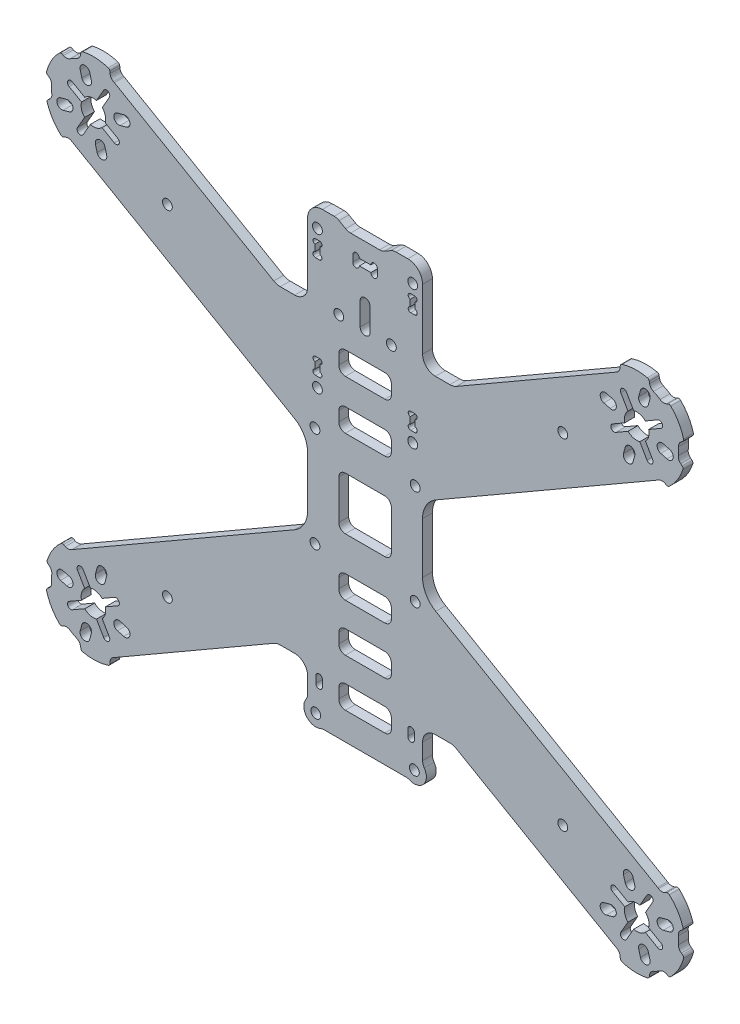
SolidWorks part; units mm, degrees
ref_plane "Plan de face" through (0, 0, 0) normal (0, 0, 1) x (1, 0, 0)
ref_plane "Plan de dessus" through (0, 0, 0) normal (0, 1, 0) x (1, 0, 0)
ref_plane "Plan de droite" through (0, 0, 0) normal (1, 0, 0) x (0, 0, -1)
ref_plane "Plan1" through (0, 0, 0) normal (0, 0, -1) x (-1, 0, 0)
sketch "Esquisse1" plane through (0, 0, 0) normal (0, 0, -1) x (-1, 0, 0)
  line L0 (80.0498, 62.0497) -> (76.2872, 59.8773)
  line L1 (75.2872, 61.6094) -> (79.0498, 63.7818)
  line L2 (80.0067, 67.3528) -> (77.8343, 71.1155)
  line L3 (79.5664, 72.1155) -> (81.7388, 68.3528)
  line L4 (85.3098, 67.396) -> (89.0725, 69.5683)
  line L5 (90.0725, 67.8363) -> (86.3098, 65.6639)
  line L6 (85.353, 62.0928) -> (87.5253, 58.3302)
  line L7 (85.7933, 57.3302) -> (83.6209, 61.0928)
  line L8 (83.2974, 72.8231) -> (83.8094, 74.7339)
  line L9 (86.7072, 73.9575) -> (86.1952, 72.0467)
  line L10 (90.7801, 64.1053) -> (92.6909, 63.5933)
  line L11 (91.9145, 60.6955) -> (90.0037, 61.2075)
  line L12 (74.5795, 65.3404) -> (72.6688, 65.8524)
  line L13 (73.4452, 68.7502) -> (75.356, 68.2382)
  line L14 (82.0623, 56.6225) -> (81.5503, 54.7117)
  line L15 (78.6525, 55.4882) -> (79.1645, 57.399)
  line L16 (-77.8343, 71.1155) -> (-80.0067, 67.3528)
  line L17 (-79.0498, 63.7818) -> (-75.2872, 61.6094)
  line L18 (-76.2872, 59.8773) -> (-80.0498, 62.0497)
  line L19 (-83.6209, 61.0928) -> (-85.7933, 57.3302)
  line L20 (-87.5253, 58.3302) -> (-85.353, 62.0928)
  line L21 (-86.3098, 65.6639) -> (-90.0725, 67.8363)
  line L22 (-89.0725, 69.5683) -> (-85.3098, 67.396)
  line L23 (-81.7388, 68.3528) -> (-79.5664, 72.1155)
  line L24 (-83.8094, 74.7339) -> (-83.2974, 72.8231)
  line L25 (-86.1952, 72.0467) -> (-86.7072, 73.9575)
  line L26 (-92.6909, 63.5933) -> (-90.7801, 64.1053)
  line L27 (-90.0037, 61.2075) -> (-91.9145, 60.6955)
  line L28 (-72.6688, 65.8524) -> (-74.5795, 65.3404)
  line L29 (-75.356, 68.2382) -> (-73.4452, 68.7502)
  line L30 (-81.5503, 54.7117) -> (-82.0623, 56.6225)
  line L31 (-79.1645, 57.399) -> (-78.6525, 55.4882)
  line L32 (77.8343, -71.1155) -> (80.0067, -67.3528)
  line L33 (79.0498, -63.7818) -> (75.2872, -61.6094)
  line L34 (76.2872, -59.8773) -> (80.0498, -62.0497)
  line L35 (83.6209, -61.0928) -> (85.7933, -57.3302)
  line L36 (87.5253, -58.3302) -> (85.353, -62.0928)
  line L37 (86.3098, -65.6639) -> (90.0725, -67.8363)
  line L38 (89.0725, -69.5683) -> (85.3098, -67.396)
  line L39 (81.7388, -68.3528) -> (79.5664, -72.1155)
  line L40 (83.8094, -74.7339) -> (83.2974, -72.8231)
  line L41 (86.1952, -72.0467) -> (86.7072, -73.9575)
  line L42 (92.6909, -63.5933) -> (90.7801, -64.1053)
  line L43 (90.0037, -61.2075) -> (91.9145, -60.6955)
  line L44 (72.6688, -65.8524) -> (74.5795, -65.3404)
  line L45 (75.356, -68.2382) -> (73.4452, -68.7502)
  line L46 (81.5503, -54.7117) -> (82.0623, -56.6225)
  line L47 (79.1645, -57.399) -> (78.6525, -55.4882)
  line L48 (-80.0498, -62.0497) -> (-76.2872, -59.8773)
  line L49 (-75.2872, -61.6094) -> (-79.0498, -63.7818)
  line L50 (-80.0067, -67.3528) -> (-77.8343, -71.1155)
  line L51 (-79.5664, -72.1155) -> (-81.7388, -68.3528)
  line L52 (-85.3098, -67.396) -> (-89.0725, -69.5683)
  line L53 (-90.0725, -67.8363) -> (-86.3098, -65.6639)
  line L54 (-85.353, -62.0928) -> (-87.5253, -58.3302)
  line L55 (-85.7933, -57.3302) -> (-83.6209, -61.0928)
  line L56 (-83.2974, -72.8231) -> (-83.8094, -74.7339)
  line L57 (-86.7072, -73.9575) -> (-86.1952, -72.0467)
  line L58 (-90.7801, -64.1053) -> (-92.6909, -63.5933)
  line L59 (-91.9145, -60.6955) -> (-90.0037, -61.2075)
  line L60 (-74.5795, -65.3404) -> (-72.6688, -65.8524)
  line L61 (-73.4452, -68.7502) -> (-75.356, -68.2382)
  line L62 (-82.0623, -56.6225) -> (-81.5503, -54.7117)
  line L63 (-78.6525, -55.4882) -> (-79.1645, -57.399)
  line L64 (6, 18.5) -> (-6, 18.5)
  line L65 (-8, 20.5) -> (-8, 23.5)
  line L66 (-6, 25.5) -> (6, 25.5)
  line L67 (8, 23.5) -> (8, 20.5)
  line L68 (-8, -23.5) -> (-8, -20.5)
  line L69 (-6, -18.5) -> (6, -18.5)
  line L70 (8, -20.5) -> (8, -23.5)
  line L71 (6, -25.5) -> (-6, -25.5)
  line L72 (8, -35) -> (8, -38)
  line L73 (6, -40) -> (-6, -40)
  line L74 (-8, -38) -> (-8, -35)
  line L75 (-6, -33) -> (6, -33)
  line L76 (6, -8) -> (-6, -8)
  line L77 (-8, -6) -> (-8, 6)
  line L78 (-6, 8) -> (6, 8)
  line L79 (8, 6) -> (8, -6)
  line L80 (-6, 40.5) -> (6, 40.5)
  line L81 (8, 38.5) -> (8, 35.5)
  line L82 (6, 33.5) -> (-6, 33.5)
  line L83 (-8, 35.5) -> (-8, 38.5)
  line L84 (8, -49.5) -> (8, -52.5)
  line L85 (6, -54.5) -> (-6, -54.5)
  line L86 (-8, -52.5) -> (-8, -49.5)
  line L87 (-6, -47.5) -> (6, -47.5)
  line L88 (1.75, 64.75) -> (-1.7553, 64.75)
  line L89 (-3.7447, 64.7474) -> (-3.75, 66.7473)
  line L90 (-1.75, 66.75) -> (1.75, 66.75)
  line L91 (3.75, 66.75) -> (3.75, 64.75)
  line L92 (-13.75, 63.7467) -> (-13.75, 61.7326)
  line L93 (-13.875, 60.2431) -> (-15.125, 60.2431)
  line L94 (-15.25, 61.7326) -> (-15.25, 63.7467)
  line L95 (-15.125, 65.25) -> (-13.875, 65.25)
  line L96 (13, -51.8906) -> (13, -49.8906)
  line L97 (15, -49.8906) -> (15, -51.8906)
  line L98 (-13.875, 29.25) -> (-15.125, 29.25)
  line L99 (-15.25, 30.7533) -> (-15.25, 32.7674)
  line L100 (-15.125, 34.2569) -> (-13.875, 34.2569)
  line L101 (-13.75, 32.7674) -> (-13.75, 30.7533)
  line L102 (13.875, 34.2569) -> (15.125, 34.2569)
  line L103 (15.25, 32.7674) -> (15.25, 30.7533)
  line L104 (15.125, 29.25) -> (13.875, 29.25)
  line L105 (13.75, 30.7533) -> (13.75, 32.7674)
  line L106 (-1.5, 48.75) -> (-1.5, 55.75)
  line L107 (1.5, 55.75) -> (1.5, 48.75)
  line L108 (-13, -49.8906) -> (-13, -51.8906)
  line L109 (-15, -51.8906) -> (-15, -49.8906)
  line L110 (15.25, 63.7467) -> (15.25, 61.7326)
  line L111 (15.125, 60.2431) -> (13.875, 60.2431)
  line L112 (13.75, 61.7326) -> (13.75, 63.7467)
  line L113 (13.875, 65.25) -> (15.125, 65.25)
  line L114 (13, 74) -> (9.4042, 74)
  line L115 (7.9164, 73.6051) -> (5.9144, 72.4617)
  line L116 (4.4266, 72.0668) -> (-4.4266, 72.0668)
  line L117 (-5.9144, 72.4617) -> (-7.9164, 73.6051)
  line L118 (-9.4042, 74) -> (-13, 74)
  line L119 (-17.5, 69.5) -> (-17.5, 51.1368)
  line L120 (-21.4101, 47.2267) -> (-25.8039, 47.2267)
  line L121 (-27.8039, 47.7626) -> (-76.3048, 75.7647)
  line L122 (-77.6193, 77.4979) -> (-77.6741, 78.1059)
  line L123 (-86.5001, 78.4912) -> (-86.6077, 77.8903)
  line L124 (-91.7746, 75.1592) -> (-92.1745, 75.3509)
  line L125 (-96.6313, 67.6315) -> (-96.2654, 67.3809)
  line L126 (-96.0472, 61.5408) -> (-96.5137, 61.1471)
  line L127 (-91.767, 53.6962) -> (-91.213, 53.9527)
  line L128 (-89.0548, 53.681) -> (-21.5, 14.6782)
  line L129 (-17.5, 7.75) -> (-17.5, -7.75)
  line L130 (-21.5, -14.6782) -> (-89.0548, -53.681)
  line L131 (-91.213, -53.9527) -> (-91.767, -53.6962)
  line L132 (-96.5137, -61.1471) -> (-96.0472, -61.5408)
  line L133 (-96.2654, -67.3809) -> (-96.6313, -67.6315)
  line L134 (-92.1745, -75.3509) -> (-91.7746, -75.1592)
  line L135 (-86.6077, -77.8903) -> (-86.5001, -78.4912)
  line L136 (-77.6741, -78.1059) -> (-77.6193, -77.4979)
  line L137 (-76.3048, -75.7647) -> (-27.8039, -47.7626)
  line L138 (-25.8039, -47.2267) -> (-21.4101, -47.2267)
  line L139 (-17.5, -51.1368) -> (-17.5, -56.0075)
  line L140 (-12.4408, -62.8906) -> (12.4408, -62.8906)
  line L141 (17.5, -56.0075) -> (17.5, -51.1368)
  line L142 (21.4101, -47.2267) -> (25.8039, -47.2267)
  line L143 (27.8039, -47.7626) -> (76.3048, -75.7647)
  line L144 (77.6193, -77.4979) -> (77.6741, -78.1059)
  line L145 (86.5001, -78.4912) -> (86.6077, -77.8903)
  line L146 (91.7746, -75.1592) -> (92.1745, -75.3509)
  line L147 (96.6313, -67.6315) -> (96.2654, -67.3809)
  line L148 (96.0472, -61.5408) -> (96.5137, -61.1471)
  line L149 (91.767, -53.6962) -> (91.213, -53.9527)
  line L150 (89.0548, -53.681) -> (21.5, -14.6782)
  line L151 (17.5, -7.75) -> (17.5, 7.75)
  line L152 (21.5, 14.6782) -> (89.0548, 53.681)
  line L153 (91.213, 53.9527) -> (91.767, 53.6962)
  line L154 (96.5137, 61.1471) -> (96.0472, 61.5408)
  line L155 (96.2654, 67.3809) -> (96.6313, 67.6315)
  line L156 (92.1745, 75.3509) -> (91.7746, 75.1592)
  line L157 (86.6077, 77.8903) -> (86.5001, 78.4912)
  line L158 (77.6741, 78.1059) -> (77.6193, 77.4979)
  line L159 (76.3048, 75.7647) -> (27.8039, 47.7626)
  line L160 (25.8039, 47.2267) -> (21.4101, 47.2267)
  line L161 (17.5, 51.1368) -> (17.5, 69.5)
  arc A0 (76.2872, 59.8773) -> (75.2872, 61.6094) centre (75.7872, 60.7433) cw
  arc A1 (79.0498, 63.7818) -> (80.0067, 67.3528) centre (82.6798, 64.7228) cw
  arc A2 (77.8343, 71.1155) -> (79.5664, 72.1155) centre (78.7004, 71.6155) cw
  arc A3 (81.7388, 68.3528) -> (85.3098, 67.396) centre (82.6798, 64.7228) cw
  arc A4 (89.0725, 69.5683) -> (90.0725, 67.8363) centre (89.5725, 68.7023) cw
  arc A5 (86.3098, 65.6639) -> (85.353, 62.0928) centre (82.6798, 64.7228) cw
  arc A6 (87.5253, 58.3302) -> (85.7933, 57.3302) centre (86.6593, 57.8302) cw
  arc A7 (83.6209, 61.0928) -> (80.0498, 62.0497) centre (82.6798, 64.7228) cw
  arc A8 (83.8094, 74.7339) -> (86.7072, 73.9575) centre (85.2583, 74.3457) cw
  arc A9 (86.1952, 72.0467) -> (83.2974, 72.8231) centre (84.7463, 72.4349) cw
  arc A10 (92.6909, 63.5933) -> (91.9145, 60.6955) centre (92.3027, 62.1444) cw
  arc A11 (90.0037, 61.2075) -> (90.7801, 64.1053) centre (90.3919, 62.6564) cw
  arc A12 (72.6688, 65.8524) -> (73.4452, 68.7502) centre (73.057, 67.3013) cw
  arc A13 (75.356, 68.2382) -> (74.5795, 65.3404) centre (74.9678, 66.7893) cw
  arc A14 (81.5503, 54.7117) -> (78.6525, 55.4882) centre (80.1014, 55.1) cw
  arc A15 (79.1645, 57.399) -> (82.0623, 56.6225) centre (80.6134, 57.0108) cw
  arc A16 (-80.0067, 67.3528) -> (-79.0498, 63.7818) centre (-82.6798, 64.7228) cw
  arc A17 (-75.2872, 61.6094) -> (-76.2872, 59.8773) centre (-75.7872, 60.7433) cw
  arc A18 (-80.0498, 62.0497) -> (-83.6209, 61.0928) centre (-82.6798, 64.7228) cw
  arc A19 (-85.7933, 57.3302) -> (-87.5253, 58.3302) centre (-86.6593, 57.8302) cw
  arc A20 (-85.353, 62.0928) -> (-86.3098, 65.6639) centre (-82.6798, 64.7228) cw
  arc A21 (-90.0725, 67.8363) -> (-89.0725, 69.5683) centre (-89.5725, 68.7023) cw
  arc A22 (-85.3098, 67.396) -> (-81.7388, 68.3528) centre (-82.6798, 64.7228) cw
  arc A23 (-79.5664, 72.1155) -> (-77.8343, 71.1155) centre (-78.7004, 71.6155) cw
  arc A24 (-83.2974, 72.8231) -> (-86.1952, 72.0467) centre (-84.7463, 72.4349) cw
  arc A25 (-86.7072, 73.9575) -> (-83.8094, 74.7339) centre (-85.2583, 74.3457) cw
  arc A26 (-90.7801, 64.1053) -> (-90.0037, 61.2075) centre (-90.3919, 62.6564) cw
  arc A27 (-91.9145, 60.6955) -> (-92.6909, 63.5933) centre (-92.3027, 62.1444) cw
  arc A28 (-74.5795, 65.3404) -> (-75.356, 68.2382) centre (-74.9678, 66.7893) cw
  arc A29 (-73.4452, 68.7502) -> (-72.6688, 65.8524) centre (-73.057, 67.3013) cw
  arc A30 (-82.0623, 56.6225) -> (-79.1645, 57.399) centre (-80.6134, 57.0108) cw
  arc A31 (-78.6525, 55.4882) -> (-81.5503, 54.7117) centre (-80.1014, 55.1) cw
  arc A32 (80.0067, -67.3528) -> (79.0498, -63.7818) centre (82.6798, -64.7228) cw
  arc A33 (75.2872, -61.6094) -> (76.2872, -59.8773) centre (75.7872, -60.7433) cw
  arc A34 (80.0498, -62.0497) -> (83.6209, -61.0928) centre (82.6798, -64.7228) cw
  arc A35 (85.7933, -57.3302) -> (87.5253, -58.3302) centre (86.6593, -57.8302) cw
  arc A36 (85.353, -62.0928) -> (86.3098, -65.6639) centre (82.6798, -64.7228) cw
  arc A37 (90.0725, -67.8363) -> (89.0725, -69.5683) centre (89.5725, -68.7023) cw
  arc A38 (85.3098, -67.396) -> (81.7388, -68.3528) centre (82.6798, -64.7228) cw
  arc A39 (79.5664, -72.1155) -> (77.8343, -71.1155) centre (78.7004, -71.6155) cw
  arc A40 (83.2974, -72.8231) -> (86.1952, -72.0467) centre (84.7463, -72.4349) cw
  arc A41 (86.7072, -73.9575) -> (83.8094, -74.7339) centre (85.2583, -74.3457) cw
  arc A42 (90.7801, -64.1053) -> (90.0037, -61.2075) centre (90.3919, -62.6564) cw
  arc A43 (91.9145, -60.6955) -> (92.6909, -63.5933) centre (92.3027, -62.1444) cw
  arc A44 (74.5795, -65.3404) -> (75.356, -68.2382) centre (74.9678, -66.7893) cw
  arc A45 (73.4452, -68.7502) -> (72.6688, -65.8524) centre (73.057, -67.3013) cw
  arc A46 (82.0623, -56.6225) -> (79.1645, -57.399) centre (80.6134, -57.0108) cw
  arc A47 (78.6525, -55.4882) -> (81.5503, -54.7117) centre (80.1014, -55.1) cw
  arc A48 (-76.2872, -59.8773) -> (-75.2872, -61.6094) centre (-75.7872, -60.7433) cw
  arc A49 (-79.0498, -63.7818) -> (-80.0067, -67.3528) centre (-82.6798, -64.7228) cw
  arc A50 (-77.8343, -71.1155) -> (-79.5664, -72.1155) centre (-78.7004, -71.6155) cw
  arc A51 (-81.7388, -68.3528) -> (-85.3098, -67.396) centre (-82.6798, -64.7228) cw
  arc A52 (-89.0725, -69.5683) -> (-90.0725, -67.8363) centre (-89.5725, -68.7023) cw
  arc A53 (-86.3098, -65.6639) -> (-85.353, -62.0928) centre (-82.6798, -64.7228) cw
  arc A54 (-87.5253, -58.3302) -> (-85.7933, -57.3302) centre (-86.6593, -57.8302) cw
  arc A55 (-83.6209, -61.0928) -> (-80.0498, -62.0497) centre (-82.6798, -64.7228) cw
  arc A56 (-83.8094, -74.7339) -> (-86.7072, -73.9575) centre (-85.2583, -74.3457) cw
  arc A57 (-86.1952, -72.0467) -> (-83.2974, -72.8231) centre (-84.7463, -72.4349) cw
  arc A58 (-92.6909, -63.5933) -> (-91.9145, -60.6955) centre (-92.3027, -62.1444) cw
  arc A59 (-90.0037, -61.2075) -> (-90.7801, -64.1053) centre (-90.3919, -62.6564) cw
  arc A60 (-72.6688, -65.8524) -> (-73.4452, -68.7502) centre (-73.057, -67.3013) cw
  arc A61 (-75.356, -68.2382) -> (-74.5795, -65.3404) centre (-74.9678, -66.7893) cw
  arc A62 (-81.5503, -54.7117) -> (-78.6525, -55.4882) centre (-80.1014, -55.1) cw
  arc A63 (-79.1645, -57.399) -> (-82.0623, -56.6225) centre (-80.6134, -57.0108) cw
  circle A64 centre (15, -59.75) radius 1.5
  circle A65 centre (-14.5, 68.25) radius 1.5
  circle A66 centre (14.5, 26.25) radius 1.5
  circle A67 centre (-15.25, 15.25) radius 1.5
  circle A68 centre (15.25, -15.25) radius 1.5
  circle A69 centre (15.25, 15.25) radius 1.5
  circle A70 centre (-15.25, -15.25) radius 1.5
  circle A71 centre (-14.5, 26.25) radius 1.5
  circle A72 centre (14.5, 68.25) radius 1.5
  circle A73 centre (-15, -59.75) radius 1.5
  arc A74 (-6, 18.5) -> (-8, 20.5) centre (-6, 20.5) cw
  arc A75 (-8, 23.5) -> (-6, 25.5) centre (-6, 23.5) cw
  arc A76 (6, 25.5) -> (8, 23.5) centre (6, 23.5) cw
  arc A77 (8, 20.5) -> (6, 18.5) centre (6, 20.5) cw
  arc A78 (-8, -20.5) -> (-6, -18.5) centre (-6, -20.5) cw
  arc A79 (6, -18.5) -> (8, -20.5) centre (6, -20.5) cw
  arc A80 (8, -23.5) -> (6, -25.5) centre (6, -23.5) cw
  arc A81 (-6, -25.5) -> (-8, -23.5) centre (-6, -23.5) cw
  arc A82 (8, -38) -> (6, -40) centre (6, -38) cw
  arc A83 (-6, -40) -> (-8, -38) centre (-6, -38) cw
  arc A84 (-8, -35) -> (-6, -33) centre (-6, -35) cw
  arc A85 (6, -33) -> (8, -35) centre (6, -35) cw
  arc A86 (-6, -8) -> (-8, -6) centre (-6, -6) cw
  arc A87 (-8, 6) -> (-6, 8) centre (-6, 6) cw
  arc A88 (6, 8) -> (8, 6) centre (6, 6) cw
  arc A89 (8, -6) -> (6, -8) centre (6, -6) cw
  arc A90 (6, 40.5) -> (8, 38.5) centre (6, 38.5) cw
  arc A91 (8, 35.5) -> (6, 33.5) centre (6, 35.5) cw
  arc A92 (-6, 33.5) -> (-8, 35.5) centre (-6, 35.5) cw
  arc A93 (-8, 38.5) -> (-6, 40.5) centre (-6, 38.5) cw
  arc A94 (8, -52.5) -> (6, -54.5) centre (6, -52.5) cw
  arc A95 (-6, -54.5) -> (-8, -52.5) centre (-6, -52.5) cw
  arc A96 (-8, -49.5) -> (-6, -47.5) centre (-6, -49.5) cw
  arc A97 (6, -47.5) -> (8, -49.5) centre (6, -49.5) cw
  arc A98 (-1.7553, 64.75) -> (-3.7447, 64.7474) centre (-2.75, 64.75) cw
  arc A99 (-3.75, 66.7473) -> (-1.75, 66.75) centre (-2.75, 66.75) cw
  arc A100 (1.75, 66.75) -> (3.75, 66.75) centre (2.75, 66.75) cw
  arc A101 (3.75, 64.75) -> (1.75, 64.75) centre (2.75, 64.75) cw
  arc A102 (-13.875, 65.25) -> (-13.75, 63.7467) centre (-13.875, 64.4931) cw
  arc A103 (-13.75, 61.7326) -> (-13.875, 60.2431) centre (-13.875, 60.9931) cw
  arc A104 (-15.125, 60.2431) -> (-15.25, 61.7326) centre (-15.125, 60.9931) cw
  arc A105 (-15.25, 63.7467) -> (-15.125, 65.25) centre (-15.125, 64.4931) cw
  arc A106 (13, -49.8906) -> (15, -49.8906) centre (14, -49.8906) cw
  arc A107 (15, -51.8906) -> (13, -51.8906) centre (14, -51.8906) cw
  arc A108 (-15.125, 29.25) -> (-15.25, 30.7533) centre (-15.125, 30.0069) cw
  arc A109 (-15.25, 32.7674) -> (-15.125, 34.2569) centre (-15.125, 33.5069) cw
  arc A110 (-13.875, 34.2569) -> (-13.75, 32.7674) centre (-13.875, 33.5069) cw
  arc A111 (-13.75, 30.7533) -> (-13.875, 29.25) centre (-13.875, 30.0069) cw
  arc A112 (15.125, 34.2569) -> (15.25, 32.7674) centre (15.125, 33.5069) cw
  arc A113 (15.25, 30.7533) -> (15.125, 29.25) centre (15.125, 30.0069) cw
  arc A114 (13.875, 29.25) -> (13.75, 30.7533) centre (13.875, 30.0069) cw
  arc A115 (13.75, 32.7674) -> (13.875, 34.2569) centre (13.875, 33.5069) cw
  arc A116 (-1.5, 55.75) -> (1.5, 55.75) centre (0, 55.75) cw
  arc A117 (1.5, 48.75) -> (-1.5, 48.75) centre (0, 48.75) cw
  arc A118 (-13, -51.8906) -> (-15, -51.8906) centre (-14, -51.8906) cw
  arc A119 (-15, -49.8906) -> (-13, -49.8906) centre (-14, -49.8906) cw
  arc A120 (15.25, 61.7326) -> (15.125, 60.2431) centre (15.125, 60.9931) cw
  arc A121 (13.875, 60.2431) -> (13.75, 61.7326) centre (13.875, 60.9931) cw
  arc A122 (13.75, 63.7467) -> (13.875, 65.25) centre (13.875, 64.4931) cw
  arc A123 (15.125, 65.25) -> (15.25, 63.7467) centre (15.125, 64.4931) cw
  circle A124 centre (8, 48.75) radius 1.5
  circle A125 centre (-8, 48.75) radius 1.5
  circle A126 centre (-60.1632, 51.7228) radius 1.5
  circle A127 centre (60.1632, -51.7228) radius 1.5
  circle A128 centre (-60.1632, -51.7228) radius 1.5
  circle A129 centre (60.1632, 51.7228) radius 1.5
  arc A130 (17.5, 69.5) -> (13, 74) centre (13, 69.5) ccw
  arc A131 (9.4042, 74) -> (7.9164, 73.6051) centre (9.4042, 71) ccw
  arc A132 (5.9144, 72.4617) -> (4.4266, 72.0668) centre (4.4266, 75.0668) cw
  arc A133 (-4.4266, 72.0668) -> (-5.9144, 72.4617) centre (-4.4266, 75.0668) cw
  arc A134 (-7.9164, 73.6051) -> (-9.4042, 74) centre (-9.4042, 71) ccw
  arc A135 (-13, 74) -> (-17.5, 69.5) centre (-13, 69.5) ccw
  arc A136 (-17.5, 51.1368) -> (-21.4101, 47.2267) centre (-21.4101, 51.1368) cw
  arc A137 (-25.8039, 47.2267) -> (-27.8039, 47.7626) centre (-25.8039, 51.2267) cw
  arc A138 (-76.3048, 75.7647) -> (-76.5836, 75.921) centre (-82.6798, 64.7228) ccw
  arc A139 (-76.5836, 75.921) -> (-77.6193, 77.4979) centre (-75.6274, 77.6776) cw
  arc A140 (-77.6741, 78.1059) -> (-78.1926, 78.7528) centre (-78.4211, 78.0385) ccw
  arc A141 (-78.1926, 78.7528) -> (-85.9272, 79.0905) centre (-82.6798, 64.7228) ccw
  arc A142 (-85.9272, 79.0905) -> (-86.5001, 78.4912) centre (-85.7618, 78.359) ccw
  arc A143 (-86.6077, 77.8903) -> (-87.7769, 76.4097) centre (-88.5764, 78.2429) cw
  arc A144 (-87.7769, 76.4097) -> (-89.7944, 75.3032) centre (-82.6798, 64.7228) ccw
  arc A145 (-89.7944, 75.3032) -> (-91.7746, 75.1592) centre (-90.9104, 76.9629) cw
  arc A146 (-92.1745, 75.3509) -> (-93.0254, 75.2084) centre (-92.4986, 74.6745) ccw
  arc A147 (-93.0254, 75.2084) -> (-96.9333, 68.4395) centre (-82.6798, 64.7228) ccw
  arc A148 (-96.9333, 68.4395) -> (-96.6313, 67.6315) centre (-96.2076, 68.2503) ccw
  arc A149 (-96.2654, 67.3809) -> (-95.4, 65.594) centre (-97.3954, 65.7307) cw
  arc A150 (-95.4, 65.594) -> (-95.3495, 63.2936) centre (-82.6798, 64.7228) ccw
  arc A151 (-95.3495, 63.2936) -> (-96.0472, 61.5408) centre (-97.3369, 63.0694) cw
  arc A152 (-96.5137, 61.1471) -> (-96.7463, 60.3513) centre (-96.0301, 60.5738) ccw
  arc A153 (-96.7463, 60.3513) -> (-92.5866, 53.8218) centre (-82.6798, 64.7228) ccw
  arc A154 (-92.5866, 53.8218) -> (-91.767, 53.6962) centre (-92.0822, 54.3768) ccw
  arc A155 (-91.213, 53.9527) -> (-89.3296, 53.8443) centre (-90.3727, 52.1378) cw
  arc A156 (-89.3296, 53.8443) -> (-89.0548, 53.681) centre (-82.6798, 64.7228) ccw
  arc A157 (-21.5, 14.6782) -> (-17.5, 7.75) centre (-25.5, 7.75) cw
  arc A158 (-17.5, -7.75) -> (-21.5, -14.6782) centre (-25.5, -7.75) cw
  arc A159 (-89.0548, -53.681) -> (-89.3296, -53.8443) centre (-82.6798, -64.7228) ccw
  arc A160 (-89.3296, -53.8443) -> (-91.213, -53.9527) centre (-90.3727, -52.1378) cw
  arc A161 (-91.767, -53.6962) -> (-92.5866, -53.8218) centre (-92.0822, -54.3768) ccw
  arc A162 (-92.5866, -53.8218) -> (-96.7463, -60.3513) centre (-82.6798, -64.7228) ccw
  arc A163 (-96.7463, -60.3513) -> (-96.5137, -61.1471) centre (-96.0301, -60.5738) ccw
  arc A164 (-96.0472, -61.5408) -> (-95.3495, -63.2936) centre (-97.3369, -63.0694) cw
  arc A165 (-95.3495, -63.2936) -> (-95.4, -65.594) centre (-82.6798, -64.7228) ccw
  arc A166 (-95.4, -65.594) -> (-96.2654, -67.3809) centre (-97.3954, -65.7307) cw
  arc A167 (-96.6313, -67.6315) -> (-96.9333, -68.4395) centre (-96.2076, -68.2503) ccw
  arc A168 (-96.9333, -68.4395) -> (-93.0254, -75.2084) centre (-82.6798, -64.7228) ccw
  arc A169 (-93.0254, -75.2084) -> (-92.1745, -75.3509) centre (-92.4986, -74.6745) ccw
  arc A170 (-91.7746, -75.1592) -> (-89.7944, -75.3032) centre (-90.9104, -76.9629) cw
  arc A171 (-89.7944, -75.3032) -> (-87.7769, -76.4097) centre (-82.6798, -64.7228) ccw
  arc A172 (-87.7769, -76.4097) -> (-86.6077, -77.8903) centre (-88.5764, -78.2429) cw
  arc A173 (-86.5001, -78.4912) -> (-85.9272, -79.0905) centre (-85.7618, -78.359) ccw
  arc A174 (-85.9272, -79.0905) -> (-78.1926, -78.7528) centre (-82.6798, -64.7228) ccw
  arc A175 (-78.1926, -78.7528) -> (-77.6741, -78.1059) centre (-78.4211, -78.0385) ccw
  arc A176 (-77.6193, -77.4979) -> (-76.5836, -75.921) centre (-75.6274, -77.6776) cw
  arc A177 (-76.5836, -75.921) -> (-76.3048, -75.7647) centre (-82.6798, -64.7228) ccw
  arc A178 (-27.8039, -47.7626) -> (-25.8039, -47.2267) centre (-25.8039, -51.2267) cw
  arc A179 (-21.4101, -47.2267) -> (-17.5, -51.1368) centre (-21.4101, -51.1368) cw
  arc A180 (-17.5, -56.0075) -> (-18.0197, -57.6952) centre (-20.5, -56.0075) cw
  arc A181 (-18.0197, -57.6952) -> (-13.5949, -63.1214) centre (-15, -59.75) ccw
  arc A182 (-13.5949, -63.1214) -> (-12.4408, -62.8906) centre (-12.4408, -65.8906) cw
  arc A183 (12.4408, -62.8906) -> (13.5949, -63.1214) centre (12.4408, -65.8906) cw
  arc A184 (13.5949, -63.1214) -> (18.0197, -57.6952) centre (15, -59.75) ccw
  arc A185 (18.0197, -57.6952) -> (17.5, -56.0075) centre (20.5, -56.0075) cw
  arc A186 (17.5, -51.1368) -> (21.4101, -47.2267) centre (21.4101, -51.1368) cw
  arc A187 (25.8039, -47.2267) -> (27.8039, -47.7626) centre (25.8039, -51.2267) cw
  arc A188 (76.3048, -75.7647) -> (76.5836, -75.921) centre (82.6798, -64.7228) ccw
  arc A189 (76.5836, -75.921) -> (77.6193, -77.4979) centre (75.6274, -77.6776) cw
  arc A190 (77.6741, -78.1059) -> (78.1926, -78.7528) centre (78.4211, -78.0385) ccw
  arc A191 (78.1926, -78.7528) -> (85.9272, -79.0905) centre (82.6798, -64.7228) ccw
  arc A192 (85.9272, -79.0905) -> (86.5001, -78.4912) centre (85.7618, -78.359) ccw
  arc A193 (86.6077, -77.8903) -> (87.7769, -76.4097) centre (88.5764, -78.2429) cw
  arc A194 (87.7769, -76.4097) -> (89.7944, -75.3032) centre (82.6798, -64.7228) ccw
  arc A195 (89.7944, -75.3032) -> (91.7746, -75.1592) centre (90.9104, -76.9629) cw
  arc A196 (92.1745, -75.3509) -> (93.0254, -75.2084) centre (92.4986, -74.6745) ccw
  arc A197 (93.0254, -75.2084) -> (96.9333, -68.4395) centre (82.6798, -64.7228) ccw
  arc A198 (96.9333, -68.4395) -> (96.6313, -67.6315) centre (96.2076, -68.2503) ccw
  arc A199 (96.2654, -67.3809) -> (95.4, -65.594) centre (97.3954, -65.7307) cw
  arc A200 (95.4, -65.594) -> (95.3495, -63.2936) centre (82.6798, -64.7228) ccw
  arc A201 (95.3495, -63.2936) -> (96.0472, -61.5408) centre (97.3369, -63.0694) cw
  arc A202 (96.5137, -61.1471) -> (96.7463, -60.3513) centre (96.0301, -60.5738) ccw
  arc A203 (96.7463, -60.3513) -> (92.5866, -53.8218) centre (82.6798, -64.7228) ccw
  arc A204 (92.5866, -53.8218) -> (91.767, -53.6962) centre (92.0822, -54.3768) ccw
  arc A205 (91.213, -53.9527) -> (89.3296, -53.8443) centre (90.3727, -52.1378) cw
  arc A206 (89.3296, -53.8443) -> (89.0548, -53.681) centre (82.6798, -64.7228) ccw
  arc A207 (21.5, -14.6782) -> (17.5, -7.75) centre (25.5, -7.75) cw
  arc A208 (17.5, 7.75) -> (21.5, 14.6782) centre (25.5, 7.75) cw
  arc A209 (89.0548, 53.681) -> (89.3296, 53.8443) centre (82.6798, 64.7228) ccw
  arc A210 (89.3296, 53.8443) -> (91.213, 53.9527) centre (90.3727, 52.1378) cw
  arc A211 (91.767, 53.6962) -> (92.5866, 53.8218) centre (92.0822, 54.3768) ccw
  arc A212 (92.5866, 53.8218) -> (96.7463, 60.3513) centre (82.6798, 64.7228) ccw
  arc A213 (96.7463, 60.3513) -> (96.5137, 61.1471) centre (96.0301, 60.5738) ccw
  arc A214 (96.0472, 61.5408) -> (95.3495, 63.2936) centre (97.3369, 63.0694) cw
  arc A215 (95.3495, 63.2936) -> (95.4, 65.594) centre (82.6798, 64.7228) ccw
  arc A216 (95.4, 65.594) -> (96.2654, 67.3809) centre (97.3954, 65.7307) cw
  arc A217 (96.6313, 67.6315) -> (96.9333, 68.4395) centre (96.2076, 68.2503) ccw
  arc A218 (96.9333, 68.4395) -> (93.0254, 75.2084) centre (82.6798, 64.7228) ccw
  arc A219 (93.0254, 75.2084) -> (92.1745, 75.3509) centre (92.4986, 74.6745) ccw
  arc A220 (91.7746, 75.1592) -> (89.7944, 75.3032) centre (90.9104, 76.9629) cw
  arc A221 (89.7944, 75.3032) -> (87.7769, 76.4097) centre (82.6798, 64.7228) ccw
  arc A222 (87.7769, 76.4097) -> (86.6077, 77.8903) centre (88.5764, 78.2429) cw
  arc A223 (86.5001, 78.4912) -> (85.9272, 79.0905) centre (85.7618, 78.359) ccw
  arc A224 (85.9272, 79.0905) -> (78.1926, 78.7528) centre (82.6798, 64.7228) ccw
  arc A225 (78.1926, 78.7528) -> (77.6741, 78.1059) centre (78.4211, 78.0385) ccw
  arc A226 (77.6193, 77.4979) -> (76.5836, 75.921) centre (75.6274, 77.6776) cw
  arc A227 (76.5836, 75.921) -> (76.3048, 75.7647) centre (82.6798, 64.7228) ccw
  arc A228 (27.8039, 47.7626) -> (25.8039, 47.2267) centre (25.8039, 51.2267) cw
  arc A229 (21.4101, 47.2267) -> (17.5, 51.1368) centre (21.4101, 51.1368) cw
extrude "Boss.-Extru.1" add sketch "Esquisse1" against normal blind 3
